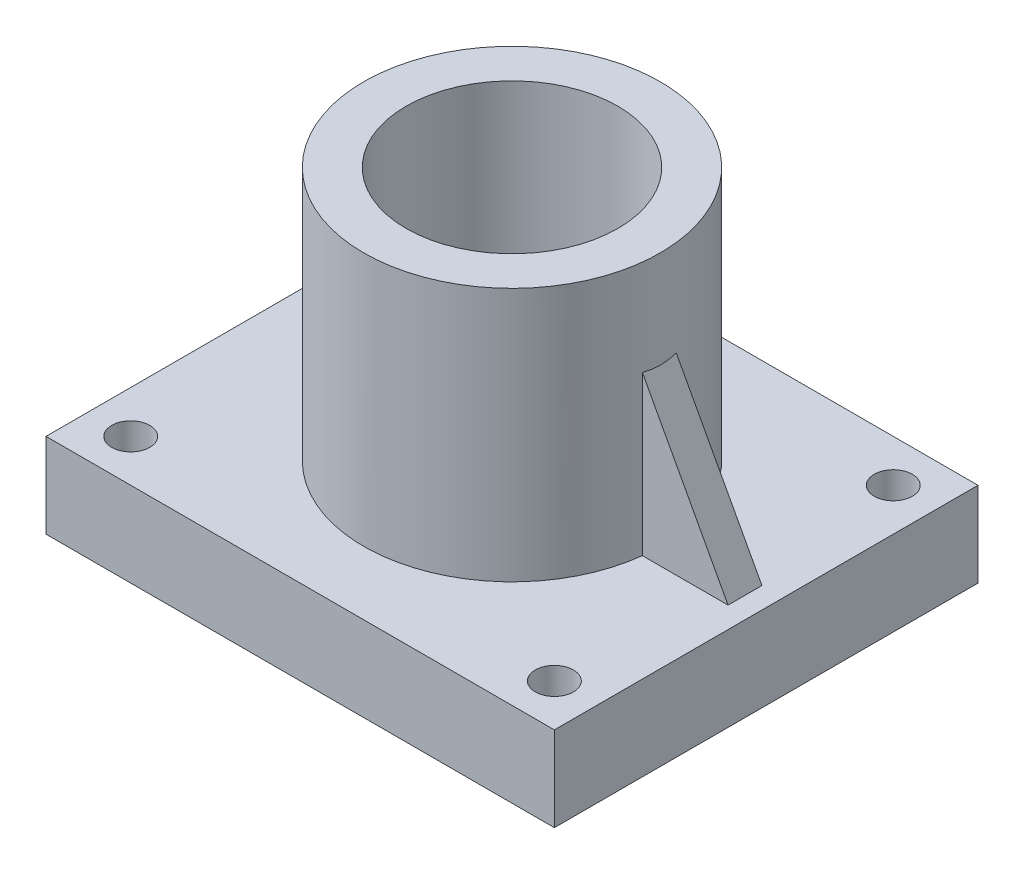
SolidWorks part; units mm, degrees
ref_plane "前视基准面" through (0, 0, 0) normal (0, 0, 1) x (1, 0, 0)
ref_plane "上视基准面" through (0, 0, 0) normal (0, 1, 0) x (1, 0, 0)
ref_plane "右视基准面" through (0, 0, 0) normal (1, 0, 0) x (0, 0, -1)
other "Configuration Table"
sketch "草图1" plane through (0, 0, 0) normal (0, 1, 0) x (1, 0, 0)
  line L1 (-60, -50) -> (60, -50)
  line L2 (-60, -50) -> (-60, 50)
  line L3 (-60, 50) -> (60, 50)
  line L4 (60, -50) -> (60, 50)
  line L5 (-60, -50) -> (60, 50) construction
  line L6 (-60, 50) -> (60, -50) construction
  point P0 (0, 0)
extrude "凸台-拉伸1" add sketch "草图1" along normal blind 20
sketch "草图2" plane through (0, 20, 0) normal (0, 1, 0) x (1, 0, 0)
  circle A0 centre (0, 0) radius 35
extrude "凸台-拉伸2" add sketch "草图2" along normal blind 60
sketch "草图3" plane through (0, 0, 0) normal (0, 1, 0) x (1, 0, 0)
  circle A0 centre (0, 0) radius 25
extrude "切除-拉伸1" cut sketch "草图3" along normal blind 85
sketch "草图4" plane through (0, 0, 0) normal (0, 0, 1) x (1, 0, 0)
  line L0 (28, 20) -> (55, 20)
  line L1 (-60, 20) -> (60, 20) construction
  line L2 (55, 20) -> (28, 70)
  line L3 (28, 70) -> (28, 20)
extrude "凸台-拉伸3" add sketch "草图4" against normal mid plane 8
sketch "草图5" plane through (0, 0, 0) normal (0, 1, 0) x (1, 0, 0)
  circle A0 centre (0, 0) radius 25
sketch "草图6" plane through (0, 0, 0) normal (0, 1, 0) x (1, 0, 0)
  circle A0 centre (50, 40) radius 4.5
extrude "切除-拉伸3" cut sketch "草图6" along normal blind 25
sketch "草图7" plane through (0, 0, 0) normal (0, 1, 0) x (1, 0, 0)
  circle A0 centre (-50, 40) radius 4.5
extrude "切除-拉伸4" cut sketch "草图7" along normal blind 25
sketch "草图8" plane through (0, 0, 0) normal (0, 1, 0) x (1, 0, 0)
  circle A0 centre (50, -40) radius 4.5
extrude "切除-拉伸5" cut sketch "草图8" along normal blind 25
sketch "草图9" plane through (0, 0, 0) normal (0, 1, 0) x (1, 0, 0)
  circle A0 centre (-50, -40) radius 4.5
extrude "切除-拉伸6" cut sketch "草图9" along normal blind 25
